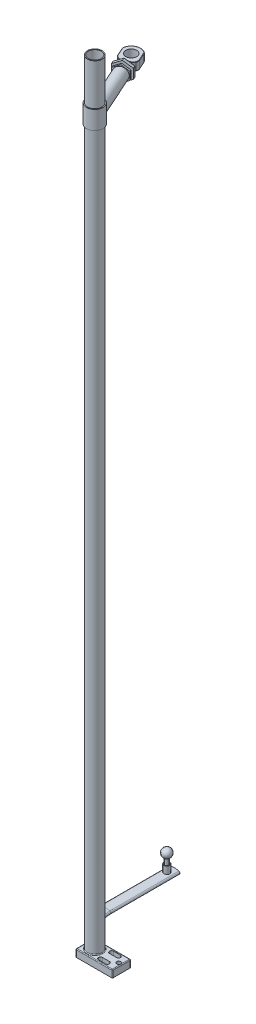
SolidWorks part; units mm, degrees
other "<Vertical Pole>-<Fillet17>"
other "<Vertical Pole>-<Revolve2>"
other "<Vertical Pole>-<Fillet14>"
ref_plane "Front Plane" through (0, 0, 0) normal (0, 0, 1) x (1, 0, 0)
ref_plane "Top Plane" through (0, 0, 0) normal (0, 1, 0) x (1, 0, 0)
ref_plane "Right Plane" through (0, 0, 0) normal (1, 0, 0) x (0, 0, -1)
mirrored part "Vertical Pole_Mirrored"
